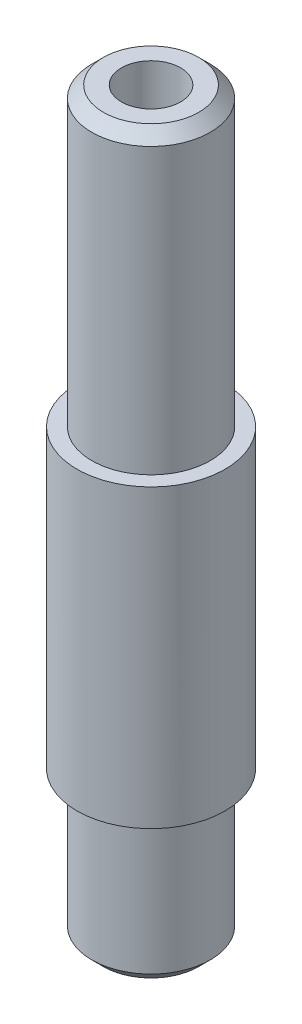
SolidWorks part; units mm, degrees
ref_plane "Front Plane" through (0, 0, 0) normal (0, 0, 1) x (1, 0, 0)
ref_plane "Top Plane" through (0, 0, 0) normal (0, 1, 0) x (1, 0, 0)
ref_plane "Right Plane" through (0, 0, 0) normal (1, 0, 0) x (0, 0, -1)
sketch "Sketch1" plane through (0, 0, 0) normal (0, 1, 0) x (1, 0, 0)
  circle A0 centre (0, 0) radius 2.5
  circle A1 centre (0, 0) radius 1
extrude "Boss-Extrude1" add sketch "Sketch1" along normal blind 25
other "M4x0.7 Machine Threads Stud1" parameters "D1"=4, "D2"=10, "D3"=10, "D4"=5
sketch "Sketch2" plane through (0, 25, 0) normal (1, 0, 0) x (0, 0, -1)
  line L5 (0, -14.3089) -> (0, 0) construction
  line L6 (1.61, 0) -> (2, -0.39)
  line L9 (2, -0.39) -> (2, -10)
  line L10 (1.61, 0) -> (2.5, 0)
  line L11 (2.5, 0) -> (2.5, -10)
  line L12 (2, -10) -> (2.5, -10)
  point P2 (0, 0)
  point P4 (0, 0)
  point P8 (0, 0)
  point P9 (0, 0)
  point P11 (8.8985, 1.1015)
  point P12 (0, 0)
  point P13 (8.8985, -2.3157)
  point P14 (10, 0)
  dimension "Minor Diameter" = 3.22
  dimension "Major Diameter" = 4
  dimension "Thread Length" = 10
  dimension "Cylinder Diameter" = 5
  dimension "Chamfer Angle" = 45
other "M4x0.7 Machine Threads Stud2" parameters "D1"=4, "D2"=10, "D3"=5, "D4"=5
sketch "Sketch3" plane through (0, 0, 0) normal (1, 0, 0) x (0, 0, 1)
  line L5 (0, -14.3089) -> (0, 0) construction
  line L6 (1.61, 0) -> (2, -0.39)
  line L9 (2, -0.39) -> (2, -5)
  line L10 (1.61, 0) -> (2.5, 0)
  line L11 (2.5, 0) -> (2.5, -5)
  line L12 (2, -5) -> (2.5, -5)
  point P2 (0, 0)
  point P4 (0, 0)
  point P8 (0, 0)
  point P9 (0, 0)
  point P11 (8.8985, 1.1015)
  point P12 (0, 0)
  point P13 (8.8985, -2.3157)
  point P14 (10, 0)
  dimension "Minor Diameter" = 3.22
  dimension "Major Diameter" = 4
  dimension "Thread Length" = 5
  dimension "Cylinder Diameter" = 5
  dimension "Chamfer Angle" = 45
